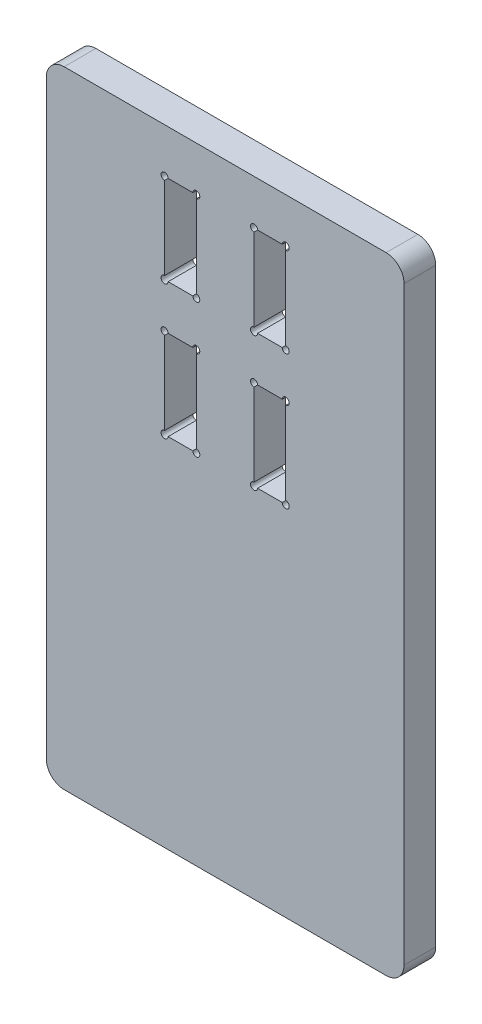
SolidWorks part; units mm, degrees
ref_plane "Front Plane" through (0, 0, 0) normal (0, 0, 1) x (1, 0, 0)
ref_plane "Top Plane" through (0, 0, 0) normal (0, 1, 0) x (1, 0, 0)
ref_plane "Right Plane" through (0, 0, 0) normal (1, 0, 0) x (0, 0, -1)
sketch "Sketch1" plane through (0, 0, 0) normal (0, 0, 1) x (1, 0, 0)
  line L0 (50.8, 66.675) -> (0, 66.675) construction
  line L1 (0, 0) -> (50.8, 0)
  line L2 (0, 0) -> (0, 88.9)
  line L3 (0, 88.9) -> (50.8, 88.9)
  line L4 (50.8, 0) -> (50.8, 88.9)
  line L5 (34, 50.8) -> (29.5, 50.8)
  line L6 (34, 50.8) -> (34, 63.5)
  line L7 (34, 63.5) -> (29.5, 63.5)
  line L8 (29.5, 50.8) -> (29.5, 63.5)
  line L9 (50.8, 44.45) -> (0, 44.45)
  line L10 (21.3, 50.8) -> (21.3, 63.5)
  line L11 (21.3, 50.8) -> (16.8, 50.8)
  line L12 (21.3, 63.5) -> (16.8, 63.5)
  line L13 (16.8, 50.8) -> (16.8, 63.5)
  line L14 (34, 50.8) -> (21.3, 50.8) construction
  line L15 (21.3, 82.55) -> (16.8, 82.55)
  line L16 (16.8, 82.55) -> (16.8, 69.85)
  line L17 (21.3, 82.55) -> (21.3, 69.85)
  line L18 (21.3, 69.85) -> (16.8, 69.85)
  line L19 (29.5, 82.55) -> (29.5, 69.85)
  line L20 (34, 69.85) -> (29.5, 69.85)
  line L21 (34, 82.55) -> (29.5, 82.55)
  line L22 (34, 82.55) -> (34, 69.85)
  line L23 (31.75, 50.8) -> (31.75, 63.5) construction
  line L24 (34, 57.15) -> (29.5, 57.15) construction
  arc A0 (33.5, 50.8) -> (34, 51.3) centre (34, 50.8) ccw
  arc A1 (33.5, 63.5) -> (34, 63) centre (34, 63.5) cw
  arc A2 (30, 63.5) -> (29.5, 63) centre (29.5, 63.5) ccw
  arc A3 (30, 50.8) -> (29.5, 51.3) centre (29.5, 50.8) cw
  arc A4 (20.8, 50.8) -> (21.3, 51.3) centre (21.3, 50.8) ccw
  arc A5 (17.3, 50.8) -> (16.8, 51.3) centre (16.8, 50.8) cw
  arc A6 (17.3, 63.5) -> (16.8, 63) centre (16.8, 63.5) ccw
  arc A7 (20.8, 63.5) -> (21.3, 63) centre (21.3, 63.5) cw
  arc A8 (30, 69.85) -> (29.5, 70.35) centre (29.5, 69.85) cw
  arc A9 (33.5, 69.85) -> (34, 70.35) centre (34, 69.85) ccw
  arc A10 (33.5, 82.55) -> (34, 82.05) centre (34, 82.55) cw
  arc A11 (30, 82.55) -> (29.5, 82.05) centre (29.5, 82.55) ccw
  arc A12 (20.8, 69.85) -> (21.3, 70.35) centre (21.3, 69.85) ccw
  arc A13 (17.3, 69.85) -> (16.8, 70.35) centre (16.8, 69.85) cw
  arc A14 (17.3, 82.55) -> (16.8, 82.05) centre (16.8, 82.55) ccw
  arc A15 (20.8, 82.55) -> (21.3, 82.05) centre (21.3, 82.55) cw
  dimension "D11" = 0.5
  dimension "D1" = 50.8
  dimension "D2" = 88.9
  dimension "D3" = 12.7
  dimension "D4" = 4.5
  dimension "D5" = 22.225
  dimension "D6" = 22.225
  dimension "D7" = 6.35
  dimension "D8" = 16.8
  dimension "D10" = 12.7
  dimension "D9" = 2
  dimension "D12" = 2
extrude "Boss-Extrude1" add sketch "Sketch1" along normal blind 4.5 contours L9 L4 L3 L2 L5 L8 L7 L6 L11 L13 L12 L10 L17 L18 L16 L15 L21 L22 L20 L19 | L4 L9 L2 L1
fillet "Fillet1" radius 2.54 4 edges at (50.8, 88.9, 2.25) (0, 88.9, 2.25) (50.8, 0, 2.25) (0, 0, 2.25)
